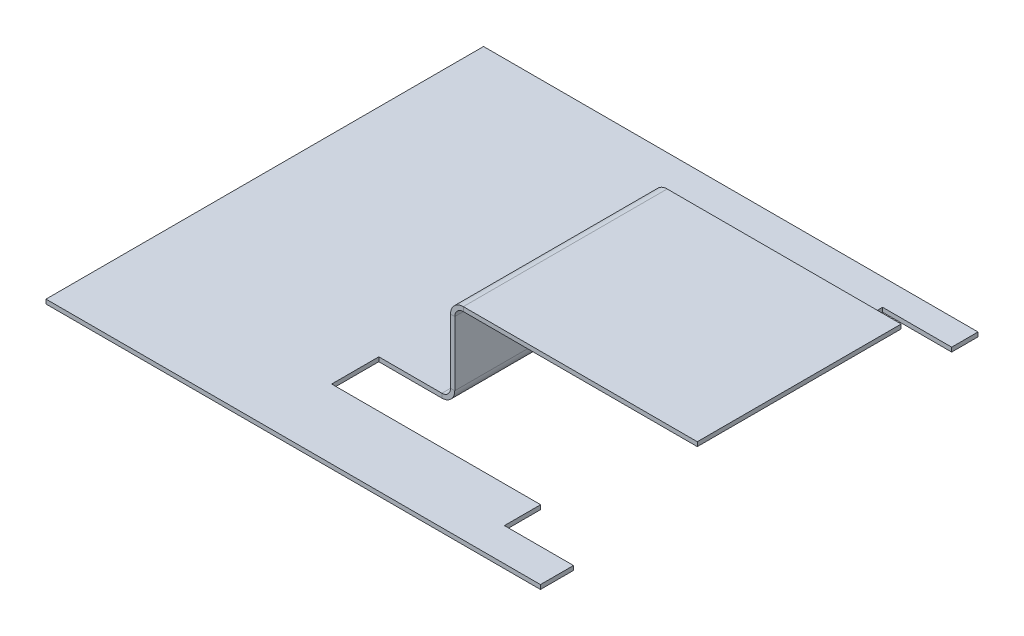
SolidWorks part; units mm, degrees
ref_plane "Front" through (0, 0, 0) normal (0, 0, 1) x (1, 0, 0)
ref_plane "Top" through (0, 0, 0) normal (0, 1, 0) x (1, 0, 0)
ref_plane "Right" through (0, 0, 0) normal (1, 0, 0) x (0, 0, -1)
sketch "Sketch1" plane through (105.9594, 0, -3.7403) normal (0, 1, 0) x (-1, 0, 0)
  line L0 (16.1231, 36.7583) -> (64.8941, 36.7583)
  line L1 (0, 52.9252) -> (115.3881, 52.9252)
  line L2 (0, 52.9252) -> (0, 45.21)
  line L3 (0, -49.1849) -> (115.3881, -49.1849)
  line L4 (115.3881, 52.9252) -> (115.3881, -49.1849)
  line L5 (64.8941, 36.7583) -> (64.8941, 25.7513)
  line L6 (64.8941, -32.0352) -> (16.1231, -32.0352)
  line L7 (16.1231, 36.7583) -> (16.1231, 45.21)
  line L8 (16.1231, 45.21) -> (0, 45.21)
  line L9 (16.1231, -32.0352) -> (16.1231, -43.0422)
  line L10 (16.1231, -43.0422) -> (0, -43.0422)
  line L11 (0, -43.0422) -> (0, -49.1849)
  line L12 (64.8941, 25.7513) -> (-9.4287, 25.7513)
  line L13 (-9.4287, 25.7513) -> (-9.4287, -21.8145)
  line L14 (-9.4287, -21.8145) -> (64.8941, -21.8145)
  line L15 (64.8941, -21.8145) -> (64.8941, -32.0352)
sheet metal parameters "Sheet-Metal2" thickness 1 parameters "D1"=2
base flange "Base-Flange2" sketch "Sketch1" thickness 1 reverse thickness direction yes parameters "D1"=2
sketch "Sketch5" plane through (0, 1, 0) normal (0, 1, 0) x (-1, 0, 0)
  line L0 (-57.7526, 22.011) -> (-57.7526, -25.5548)
  line L1 (-41.0653, 22.011) -> (-115.3881, 22.011) construction
  line L2 (-115.3881, -25.5548) -> (-41.0653, -25.5548) construction
jog "Jog5" parameters "D1"=2
bend "JogBend9" bend radius 2 bend angle 90 parameters "D5"=1
bend "JogBend10" bend radius 2 bend angle 90 parameters "D5"=2
flat pattern "Flat-Pattern2"
sketch "Bend-Lines2" plane through (0, 1, 0) normal (0, 1, 0) x (-1, 0, 0)
  line L0 (-108.1406, 22.011) -> (-108.1406, -25.5548) construction
  line L1 (-57.7526, -25.5548) -> (-57.7526, 22.011) construction
bend of the flat pattern "Flatten-<JogBend9>2"
bend of the flat pattern "Flatten-<JogBend10>2"
